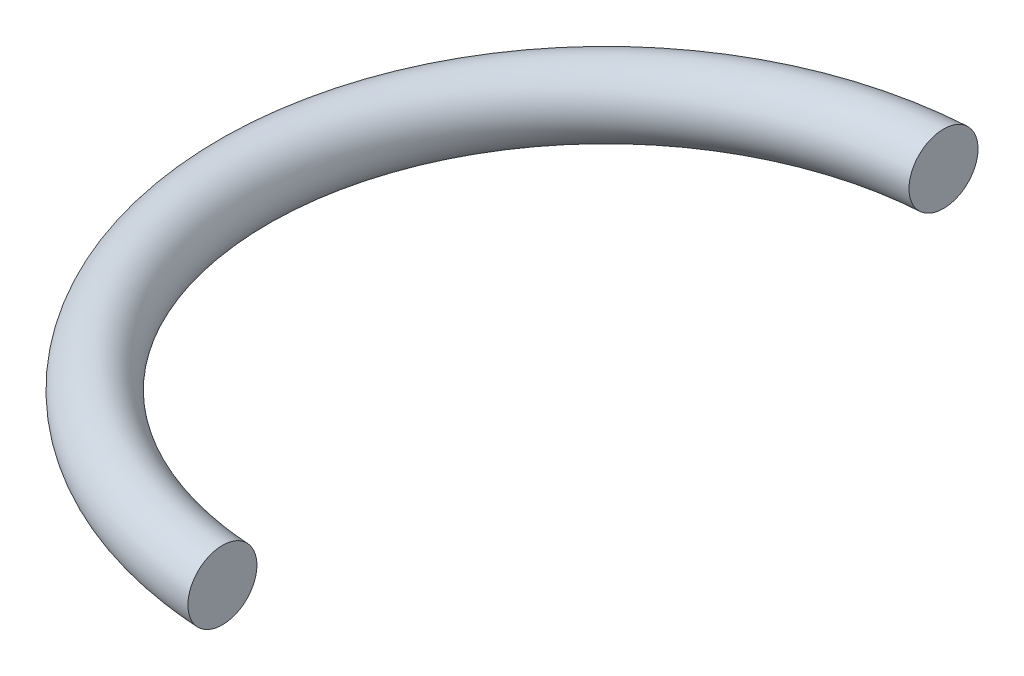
SolidWorks part; units mm, degrees
ref_plane "Frontal" through (0, 0, 0) normal (0, 0, 1) x (1, 0, 0)
ref_plane "Horizontal" through (0, 0, 0) normal (0, 1, 0) x (1, 0, 0)
ref_plane "Profil" through (0, 0, 0) normal (1, 0, 0) x (0, 0, -1)
sketch "Esquisse1" plane through (0, 0, 0) normal (0, 0, 1) x (1, 0, 0)
  line L0 (0, 41.0334) -> (0, -33.1997) construction
  circle A0 centre (16, 0) radius 1.525
  dimension "D1" = 3.05
  dimension "D2" = 16
revolve "Base-Révolution" add sketch "Esquisse1" angle 360 about L0
sketch "Esquisse2" plane through (0, 0, 0) normal (0, 1, 0) x (1, 0, 0)
  line L0 (-1, 18.7733) -> (-1, -19.5135)
  dimension "D1" = 1
extrude "Enlèv. mat.-Extru.1" cut sketch "Esquisse2" against normal through all and the other way through all
